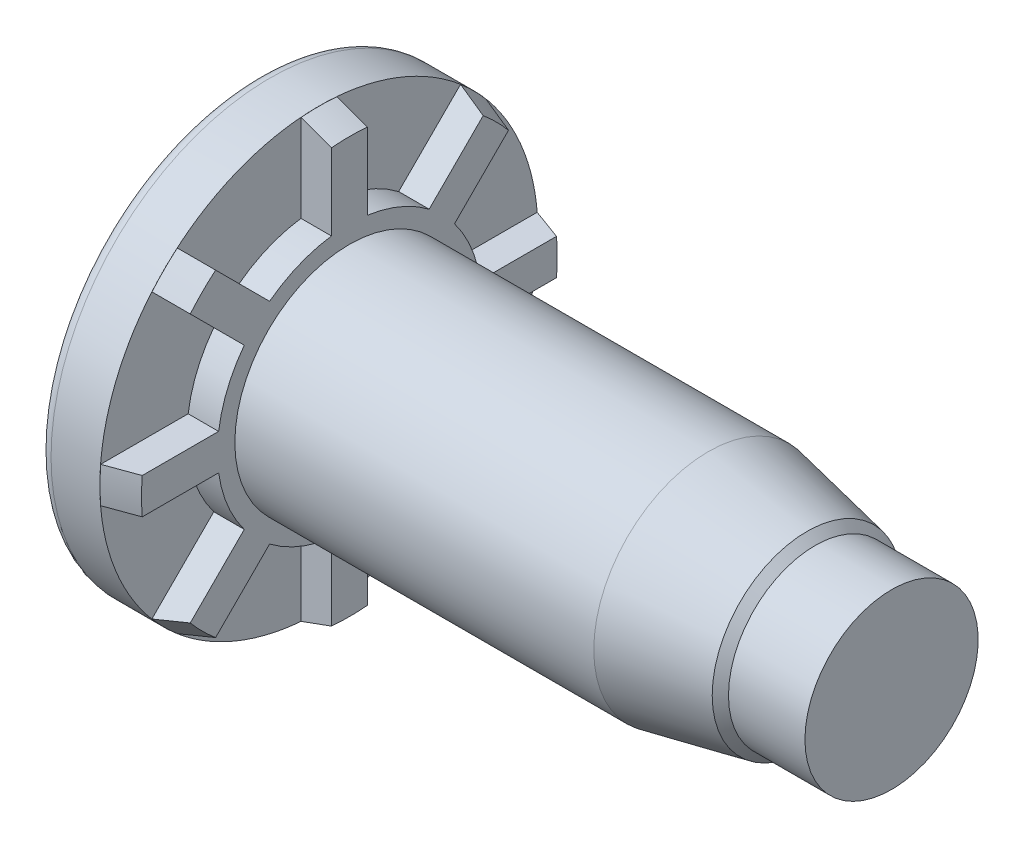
SolidWorks part; units mm, degrees
ref_plane "Plane1" through (0, 0, 0) normal (0, 0, 1) x (1, 0, 0)
ref_plane "Plane2" through (0, 0, 0) normal (0, 1, 0) x (1, 0, 0)
ref_plane "Plane3" through (0, 0, 0) normal (1, 0, 0) x (0, 0, -1)
sketch "BodySke" plane through (0, 0, 0) normal (0, 0, 1) x (1, 0, 0)
  line L0 (-2.13, 7.224) -> (-2.13, 0)
  line L1 (1.065, 7.2608) -> (1.065, 4)
  line L2 (0.0025, 7.6475) -> (1.065, 7.2608)
  line L3 (1.065, 4) -> (13.6, 4)
  line L4 (13.6, 4) -> (17.0455, 3.3095)
  line L5 (20, 0) -> (-2.13, 0)
  line L6 (0, 0) -> (50.554, 0) construction
  line L7 (17.33, 3.025) -> (20, 3.025)
  line L8 (17.33, 3.025) -> (17.0455, 3.3095)
  line L9 (-1.704, 7.65) -> (0, 7.65)
  line L10 (0.0025, 7.6475) -> (0, 7.6475)
  line L11 (1.25, 19.05) -> (1.25, -3.175) construction
  line L12 (0, 7.6475) -> (0, 7.65)
  line L13 (20, 3.025) -> (20, 0)
  arc A0 (-2.13, 7.224) -> (-1.704, 7.65) centre (-1.704, 7.224) cw
  dimension "D2" = 0.0025
  dimension "Fillet_rad" = 0.426
  dimension "D1" = 20
  dimension "Diameter" = 8
  dimension "D3" = 0.0025
  dimension "D4" = 45
  dimension "Length" = 20
  dimension "Minor_dia" = 6.619
  dimension "Advance" = 1.25
  dimension "H_dia" = 15.3
  dimension "T_dim" = 2.13
  dimension "Clinch_ht" = 1.065
  dimension "Dog_len" = 2.67
  dimension "Dog_dia" = 6.05
  dimension "Thread_trans" = 3.73
revolve "BaseBody" add sketch "BodySke" angle 360 about L6
sketch "ThdSchSke" plane through (0, 0, 0) normal (0, 0, 1) x (1, 0, 0)
  line L0 (3.3, -3.3095) -> (2.8165, -4)
  line L1 (3.3, -3.3095) -> (3.7835, -4)
  line L2 (3.7835, -4) -> (3.7835, -5)
  line L3 (-3.175, 0) -> (5.1513, 0) construction
  line L4 (0, -7.65) -> (0, 7.65) construction
  line L5 (3.7835, -5) -> (2.8165, -5)
  line L6 (2.8165, -5) -> (2.8165, -4)
  line L7 (21.3518, 6.5809) -> (21.3518, 1.1961) construction
  dimension "Thread_minor" = 6.619
  dimension "Diameter" = 8
  dimension "Start" = 3.3
  dimension "SideAngle" = 55
  dimension "VeeAngle" = 70
  dimension "Overcut" = 10
  dimension "Thread_length" = 18.0518
revolve "ThreadSchematic" [suppressed] cut sketch "ThdSchSke" angle 360 about L3
pattern_linear "ThdSchPat" [suppressed]
sketch "RibCutSke" plane through (1.065, 1.7944, -0.091) normal (1, 0, 0) x (0, 0, -1)
  line L0 (0.5348, 2.7713) -> (0.5348, 5.83)
  line L1 (2.695, 1.8765) -> (4.8578, 4.0393)
  line L2 (0.5348, 2.1564) -> (0.5348, 2.4006) construction
  line L3 (-0.091, -1.7944) -> (-0.091, 5.0239) construction
  line L4 (-0.091, -1.7944) -> (0.5348, 2.1564) construction
  line L5 (-0.091, -1.7944) -> (2.2602, 1.4417) construction
  line L6 (2.2602, 1.4417) -> (2.4379, 1.6194) construction
  arc A1 (2.695, 1.8765) -> (0.5348, 2.7713) centre (-0.091, -1.7944) ccw
  arc A2 (4.8578, 4.0393) -> (0.5348, 5.83) centre (-0.091, -1.7944) ccw
  circle A3 centre (-0.091, -1.7944) radius 7.2608 construction
  circle A4 centre (-0.091, -1.7944) radius 4 construction
  dimension "Inner_dia" = 9.2167
  dimension "Outer_dia" = 15.3
  dimension "Rib_root_dia" = 8
  dimension "Rib_root_half_angle" = 9
  dimension "Rib_root_gap_angle" = 27
  dimension "Angle" = 45
extrude "RibCut" cut sketch "RibCutSke" against normal blind 1.065
pattern_circular "RibCutsPat" count 8 every 45 about axis through (0, 0, 0) along (1, 0, 0) of "RibCut"
equation "' \"Length@BodySke\" = 20"
equation "' \"H_dia@BodySke\" = 15.3"
equation "' \"Start@ThdSchSke\" = 3.3"
equation "' \"T_dim@BodySke\" = 2.13"
equation "' \"Dog_dia@BodySke\" = 6.05"
equation "' \"Dog_len@BodySke\" = 2.67"
equation "' \"Thread_trans@BodySke\" = 3.73"
equation "' \"Diameter@BodySke\" = 8"
equation "' \"Minor_dia@BodySke\" =  6.619"
equation "' \"Advance@BodySke\" = 1.25"
equation "\"Fillet_rad@BodySke\" =  \"T_dim@BodySke\" * 0.2"
equation "\"Clinch_ht@BodySke\" = \"T_dim@BodySke\" * 0.5"
equation "\"Num_ribs@RibCutsPat\" = 8"
equation "\"Angle@RibCutSke\" =\"Angle@RibCutsPat\""
equation "\"Rib_root_half_angle@RibCutSke\" = \"Angle@RibCutSke\" / 5"
equation "\"Rib_root_gap_angle@RibCutSke\" = \"Angle@RibCutSke\" - (2 * \"Rib_root_half_angle@RibCutSke\" )"
equation "\"Rib_root_dia@RibCutSke\" = \"Diameter@BodySke\""
equation "\"Inner_dia@RibCutSke\" = \"Diameter@BodySke\" + ( \"H_dia@BodySke\" - \"Diameter@BodySke\" ) / 6"
equation "\"Outer_dia@RibCutSke\" = \"H_dia@BodySke\""
equation "\"Depth@RibCut\" = \"Clinch_ht@BodySke\""
equation "\"Thread_length@ThreadCosmetic\" = \"Length@BodySke\" - \"Start@ThdSchSke\"  - \"Dog_len@BodySke\"  - ( \"Minor_dia@BodySke\" - \"Dog_dia@BodySke\" ) / 2"
equation "\"Thread_minor@ThreadCosmetic\" = \"Minor_dia@BodySke\""
equation "\"Thread_minor@ThdSchSke\" = \"Minor_dia@BodySke\""
equation "\"Diameter@ThdSchSke\" = \"Diameter@BodySke\""
equation "\"Overcut@ThdSchSke\" = \"Diameter@BodySke\" * 1.25"
equation "\"Num_threads@ThdSchPat\" = int( \"Thread_length@ThreadCosmetic\" / \"Advance@BodySke\" + 0.999 )  + 1"
equation "\"Advance@ThdSchPat\" = \"Thread_length@ThreadCosmetic\" /  (\"Num_threads@ThdSchPat\" - 1) 'relax it"
equation "\"Num_threads@ThdSchPat\" = \"Num_threads@ThdSchPat\" - sgn( \"Num_threads@ThdSchPat\" - 1) '---chamfered tips only---"
